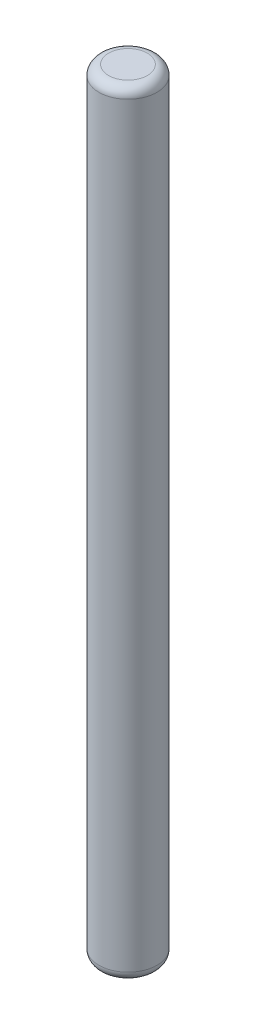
SolidWorks part; units mm, degrees
ref_plane "Спереди" through (0, 0, 0) normal (0, 0, 1) x (1, 0, 0)
ref_plane "Сверху" through (0, 0, 0) normal (0, 1, 0) x (1, 0, 0)
ref_plane "Справа" through (0, 0, 0) normal (1, 0, 0) x (0, 0, -1)
sketch "Эскиз1" plane through (0, 0, 0) normal (0, 1, 0) x (1, 0, 0)
  circle A0 centre (0, 0) radius 0.75
  dimension "D1" = 1.5
extrude "Бобышка-Вытянуть1" add sketch "Эскиз1" along normal mid plane 20
fillet "Скругление1" radius 0.25 2 edges at (0, -10, 0.75) (0, 10, 0.75)
